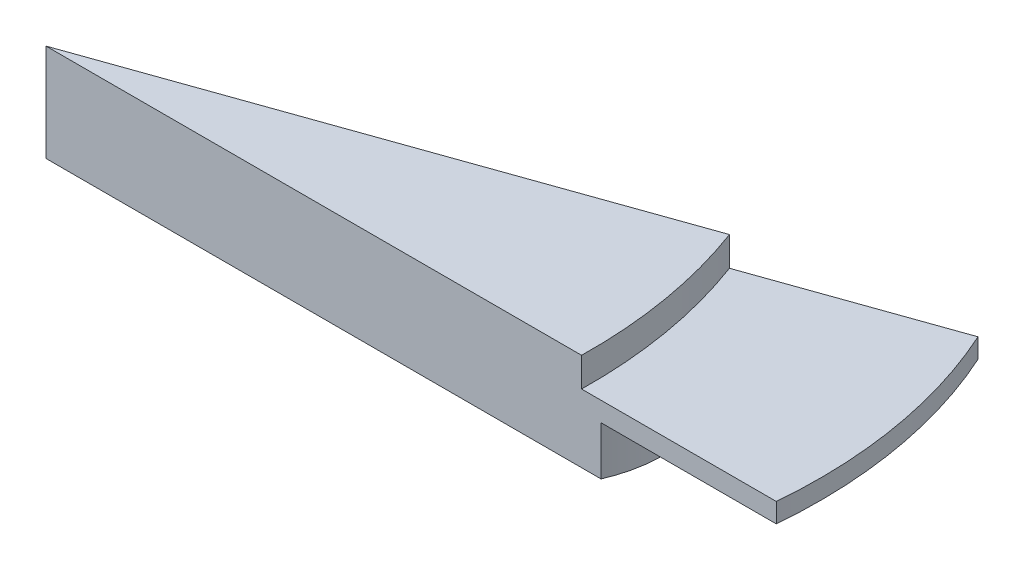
SolidWorks part; units mm, degrees
ref_plane "Front Plane" through (0, 0, 0) normal (0, 0, 1) x (1, 0, 0)
ref_plane "Top Plane" through (0, 0, 0) normal (0, 1, 0) x (1, 0, 0)
ref_plane "Right Plane" through (0, 0, 0) normal (1, 0, 0) x (0, 0, -1)
sketch "Sketch1" plane through (0, 0, 0) normal (0, 1, 0) x (1, 0, 0)
  line L0 (0, 0) -> (75, 0)
  line L1 (0, 0) -> (70.7107, 25)
  arc A0 (70.7107, 25) -> (75, 0) centre (25.1871, 4.3214) cw
  dimension "D3" = 50
  dimension "D1" = 75
  dimension "D2" = 75
  dimension "D4" = 25
extrude "Boss-Extrude1" add sketch "Sketch1" along normal blind 10
sketch "Sketch2" plane through (0, 10, 0) normal (0, 1, 0) x (1, 0, 0)
  line L0 (70.7107, 25) -> (0, 0) construction
  line L1 (0, 0) -> (75, 0) construction
  line L2 (51.8545, 18.3333) -> (70.7107, 25)
  line L3 (55, 0) -> (75, 0)
  arc A0 (51.8545, 18.3333) -> (55, 0) centre (5.0074, 0.8591) cw
  arc A1 (70.7107, 25) -> (75, 0) centre (25.1871, 4.3214) cw
  dimension "D1" = 50
  dimension "D2" = 55
  dimension "D3" = 55
extrude "Cut-Extrude1" cut sketch "Sketch2" against normal blind 3
sketch "Sketch3" plane through (0, 0, 0) normal (0, -1, 0) x (1, 0, 0)
  line L0 (70.7107, -25) -> (0, 0) construction
  line L3 (0, 0) -> (75, 0) construction
  line L4 (57, 0) -> (75, 0)
  line L5 (49.9689, -17.6667) -> (70.7107, -25)
  arc A0 (49.9689, -17.6667) -> (57, 0) centre (44.6832, -5.3305) ccw
  arc A1 (70.7107, -25) -> (75, 0) centre (25.1871, -4.3214) ccw
  dimension "D1" = 53
  dimension "D3" = 45
  dimension "D2" = 57
extrude "Cut-Extrude2" cut sketch "Sketch3" against normal blind 5
